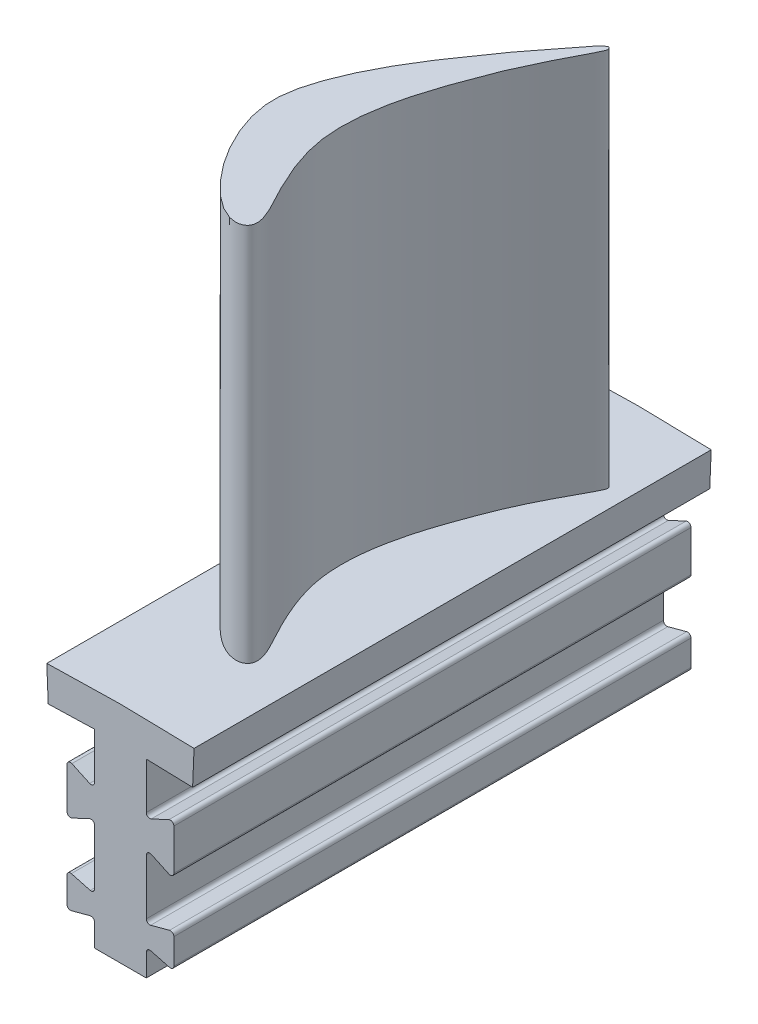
SolidWorks part; units mm, degrees
ref_plane "Front Plane" through (0, 0, 0) normal (0, 0, 1) x (1, 0, 0)
ref_plane "Top Plane" through (0, 0, 0) normal (0, 1, 0) x (1, 0, 0)
ref_plane "Right Plane" through (0, 0, 0) normal (1, 0, 0) x (0, 0, -1)
sketch "Sketch1" plane through (0, 0, 0) normal (0, 0, 1) x (1, 0, 0)
  line L0 (0, 500) -> (0, 510) construction
  line L1 (-20.9378, 499.5614) -> (-21.3566, 509.5526)
  line L2 (20.9378, 499.5614) -> (21.3566, 509.5526)
  arc A0 (20.9378, 499.5614) -> (-20.9378, 499.5614) centre (0, 0) ccw
  arc A1 (21.3566, 509.5526) -> (-21.3566, 509.5526) centre (0, 0) ccw
  dimension "D1" = 4.8
extrude "Boss-Extrude1" add sketch "Sketch1" along normal mid plane 150
ref_plane "Plane1" through (0, 750, 0) normal (0, 1, 0) x (1, 0, 0)
sketch "Sketch5" plane through (0, 0, 75) normal (0, 0, 1) x (1, 0, 0)
  line L0 (0, 500) -> (0, 402.3966) construction
  line L1 (-7.5, 499.9437) -> (-7.5, 486.5134)
  line L2 (-8.9226, 485.6071) -> (-14.0774, 488.0108)
  line L3 (-15.5, 487.1045) -> (-15.5, 475.2439)
  line L4 (-14.0774, 474.3376) -> (-8.9226, 476.7413)
  line L5 (-7.5, 475.835) -> (-7.5, 459.7971)
  line L6 (-8.7588, 458.8312) -> (-14.2412, 460.3002)
  line L7 (-15.5, 459.3343) -> (-15.5, 451.9407)
  line L8 (-14.2412, 450.9748) -> (-8.7588, 452.4438)
  line L9 (-7.5, 451.4779) -> (-7.5, 444.9437)
  line L10 (7.5, 499.9437) -> (7.5, 486.5134)
  line L11 (-7.5, 400) -> (3.7216, 400)
  line L12 (-7.5, 444.9437) -> (7.5, 444.9437)
  line L13 (8.9226, 485.6071) -> (14.0774, 488.0108)
  line L14 (15.5, 487.1045) -> (15.5, 475.2439)
  line L15 (14.0774, 474.3376) -> (8.9226, 476.7413)
  line L16 (7.5, 475.835) -> (7.5, 459.7971)
  line L17 (8.7588, 458.8312) -> (14.2412, 460.3002)
  line L18 (15.5, 459.3343) -> (15.5, 451.9407)
  line L19 (14.2412, 450.9748) -> (8.7588, 452.4438)
  line L20 (7.5, 451.4779) -> (7.5, 444.9437)
  arc A0 (20.9378, 499.5614) -> (-20.9378, 499.5614) centre (0, 0) ccw construction
  arc A1 (-14.2412, 460.3002) -> (-15.5, 459.3343) centre (-14.5, 459.3343) ccw
  arc A2 (-15.5, 451.9407) -> (-14.2412, 450.9748) centre (-14.5, 451.9407) ccw
  arc A3 (-8.7588, 452.4438) -> (-7.5, 451.4779) centre (-8.5, 451.4779) cw
  arc A4 (-7.5, 459.7971) -> (-8.7588, 458.8312) centre (-8.5, 459.7971) cw
  arc A5 (-8.9226, 476.7413) -> (-7.5, 475.835) centre (-8.5, 475.835) cw
  arc A6 (-7.5, 486.5134) -> (-8.9226, 485.6071) centre (-8.5, 486.5134) cw
  arc A7 (-14.0774, 488.0108) -> (-15.5, 487.1045) centre (-14.5, 487.1045) ccw
  arc A8 (-15.5, 475.2439) -> (-14.0774, 474.3376) centre (-14.5, 475.2439) ccw
  arc A9 (7.5, 486.5134) -> (8.9226, 485.6071) centre (8.5, 486.5134) ccw
  arc A10 (14.0774, 488.0108) -> (15.5, 487.1045) centre (14.5, 487.1045) cw
  arc A11 (15.5, 475.2439) -> (14.0774, 474.3376) centre (14.5, 475.2439) cw
  arc A12 (8.9226, 476.7413) -> (7.5, 475.835) centre (8.5, 475.835) ccw
  arc A13 (7.5, 459.7971) -> (8.7588, 458.8312) centre (8.5, 459.7971) ccw
  arc A14 (14.2412, 460.3002) -> (15.5, 459.3343) centre (14.5, 459.3343) cw
  arc A15 (15.5, 451.9407) -> (14.2412, 450.9748) centre (14.5, 451.9407) cw
  arc A16 (8.7588, 452.4438) -> (7.5, 451.4779) centre (8.5, 451.4779) ccw
  arc A17 (7.5, 499.9437) -> (-7.5, 499.9437) centre (0, 0) ccw
  point P21 (-15.5, 460.6375)
  point P25 (-15.5, 450.6375)
  point P34 (-7.5, 484.9437)
  point P37 (-15.5, 488.6742)
  point P40 (-15.5, 473.6742)
  point P67 (0, 444.9437)
  dimension "D9" = 55
  dimension "D14" = 1
  dimension "D1" = 65
  dimension "D2" = 65
  dimension "D3" = 75
  dimension "D4" = 7.5
  dimension "D5" = 7.5
  dimension "D6" = 7.5
  dimension "D7" = 15
  dimension "D8" = 10
  dimension "D10" = 75
  dimension "D11" = 15
  dimension "D12" = 8
  dimension "D13" = 8
extrude "Boss-Extrude5" add sketch "Sketch5" against normal up to surface (150 mm away) contours L4 A5 L5 A4 L6 A1 L7 A2 L8 A3 L9 L12 L20 A16 L19 A15 L18 A14 L17 A13 L16 A12 L15 A11 L14 A10 L13 A9 L10 A17 L1 A6 L2 A7 L3 A8
sketch "Sketch6" plane through (0, 750, 0) normal (0, 1, 0) x (1, 0, 0)
  line L0 (-17.003, -84.8922) -> (195.0131, 0.7679) construction
  line L2 (15.6514, 50.8983) -> (14.5317, 50.4184) construction
  line L3 (14.5317, 50.4184) -> (13.8919, 49.6719) construction
  line L4 (13.8919, 49.6719) -> (13.1987, 48.8188) construction
  line L5 (13.1987, 48.8188) -> (12.7722, 48.179) construction
  line L6 (12.7722, 48.179) -> (11.9191, 46.9527) construction
  line L7 (11.9191, 46.9527) -> (11.4925, 46.5794) construction
  line L8 (11.4925, 46.5794) -> (11.0127, 45.833) construction
  line L9 (11.0127, 45.833) -> (10.5328, 45.3531) construction
  line L10 (10.5328, 45.3531) -> (9.9463, 44.3934) construction
  line L11 (9.9463, 44.3934) -> (9.4131, 43.5936) construction
  line L12 (9.4131, 43.5936) -> (8.4534, 42.154) construction
  line L13 (8.4534, 42.154) -> (6.6878, 40.5093) construction
  line L14 (6.6878, 40.5093) -> (5.7769, 39.4971) construction
  line L15 (5.7769, 39.4971) -> (4.8406, 38.3585) construction
  line L16 (4.8406, 38.3585) -> (4.1827, 37.4222) construction
  line L17 (4.1827, 37.4222) -> (3.5248, 36.4859) construction
  line L18 (3.5248, 36.4859) -> (2.538, 35.0183) construction
  line L19 (2.538, 35.0183) -> (1.5005, 33.8037) construction
  line L20 (1.5005, 33.8037) -> (0.6148, 32.4373) construction
  line L21 (0.6148, 32.4373) -> (-0.0431, 31.2733) construction
  line L22 (-0.0431, 31.2733) -> (-0.5745, 30.2864) construction
  line L23 (-0.5745, 30.2864) -> (-1.2071, 29.1224) construction
  line L24 (-1.2071, 29.1224) -> (-2.0421, 28.2874) construction
  line L25 (-2.0421, 28.2874) -> (-2.447, 27.6548) construction
  line L26 (-2.447, 27.6548) -> (-3.0037, 26.9463) construction
  line L27 (-3.0037, 26.9463) -> (-4.0715, 25.5481) construction
  line L28 (-4.0715, 25.5481) -> (-4.604, 24.6093) construction
  line L29 (-4.604, 24.6093) -> (-5.3466, 23.6705) construction
  line L30 (-5.3466, 23.6705) -> (-5.739, 23.054) construction
  line L31 (-5.739, 23.054) -> (-6.1734, 22.4935) construction
  line L32 (-6.1734, 22.4935) -> (-6.5377, 21.947) construction
  line L33 (-6.5377, 21.947) -> (-7.238, 20.821) construction
  line L34 (-7.238, 20.821) -> (-7.7324, 20.0794) construction
  line L35 (-7.7324, 20.0794) -> (-8.3779, 19.1043) construction
  line L36 (-8.3779, 19.1043) -> (-8.7075, 18.4313) construction
  line L37 (-8.7075, 18.4313) -> (-9.0783, 17.8682) construction
  line L38 (-9.0783, 17.8682) -> (-9.9998, 16.4444) construction
  line L39 (-9.9998, 16.4444) -> (-10.6616, 15.2572) construction
  line L40 (-10.6616, 15.2572) -> (-11.1871, 14.2256) construction
  line L41 (-11.1871, 14.2256) -> (-11.5958, 13.525) construction
  line L42 (-11.5958, 13.525) -> (-12.2335, 12.5823) construction
  line L43 (-12.2335, 12.5823) -> (-13.2661, 11.0731) construction
  line L44 (-13.2661, 11.0731) -> (-13.9413, 9.4448) construction
  line L45 (-13.9413, 9.4448) -> (-15.0533, 7.737) construction
  line L46 (-15.0533, 7.737) -> (-15.5696, 6.2278) construction
  line L47 (-15.5696, 6.2278) -> (-16.1256, 5.1952) construction
  line L48 (-16.1256, 5.1952) -> (-16.5228, 4.1626) construction
  line L49 (-16.5228, 4.1626) -> (-17.1582, 3.0506) construction
  line L50 (-17.1582, 3.0506) -> (-17.5554, 1.9782) construction
  line L51 (-17.5554, 1.9782) -> (-18.1908, 0.2705) construction
  line L52 (-18.1908, 0.2705) -> (-18.4688, -1.3976) construction
  line L53 (-18.4688, -1.3976) -> (-19.0584, -3.0417) construction
  line L55 (-19.0584, -3.0417) -> (-19.5501, -4.6954) construction
  line L56 (-19.5501, -4.6954) -> (-19.8406, -5.7234) construction
  line L57 (-19.8406, -5.7234) -> (-19.997, -6.7514) construction
  line L58 (-19.997, -6.7514) -> (-20.2205, -7.757) construction
  line L59 (-20.2205, -7.757) -> (-20.2205, -8.4274) construction
  line L60 (-20.2205, -8.4274) -> (-20.2205, -9.0308) construction
  line L61 (-20.2205, -9.0308) -> (-20.4216, -9.7906) construction
  line L62 (-20.4216, -9.7906) -> (-20.4216, -10.5728) construction
  line L63 (-20.4216, -10.5728) -> (-20.4216, -11.2432) construction
  line L64 (-20.4216, -11.2432) -> (-20.4216, -12.2489) construction
  line L65 (-20.4216, -12.2489) -> (-20.4216, -12.9193) construction
  line L66 (-20.4216, -12.9193) -> (-20.4216, -13.81) construction
  line L67 (-20.4216, -13.81) -> (-20.4216, -15.0819) construction
  line L68 (-20.4216, -15.0819) -> (-20.0402, -16.1629) construction
  line L69 (-20.0402, -16.1629) -> (-20.0402, -17.2122) construction
  line L70 (-20.0402, -17.2122) -> (-19.4996, -18.4205) construction
  line L71 (-19.4996, -18.4205) -> (-19.2135, -19.6287) construction
  line L72 (-19.2135, -19.6287) -> (-18.8944, -21.167) construction
  line L73 (-18.8944, -21.167) -> (-18.0957, -22.6871) construction
  line L74 (-18.0957, -22.6871) -> (-17.5546, -24.3875) construction
  line L75 (-17.5546, -24.3875) -> (-16.9106, -26.7062) construction
  line L76 (-16.9106, -26.7062) -> (-16.1376, -28.6385) construction
  line L77 (-16.1376, -28.6385) -> (-15.4163, -29.7721) construction
  line L78 (-15.4163, -29.7721) -> (-14.7722, -31.3179) construction
  line L79 (-14.7722, -31.3179) -> (-14.1538, -32.6834) construction
  line L80 (-14.1538, -32.6834) -> (-13.5613, -33.5593) construction
  line L81 (-13.5613, -33.5593) -> (-11.3632, -35.5828) construction
  line L82 (-11.3632, -35.5828) -> (-9.6984, -37.2914) construction
  line L83 (-9.6984, -37.2914) -> (-8.2964, -39.0001) construction
  line L84 (-8.2964, -39.0001) -> (-7.0259, -40.402) construction
  line L85 (-7.0259, -40.402) -> (-5.6239, -41.7164) construction
  line L86 (-5.6239, -41.7164) -> (-4.4574, -42.6089) construction
  line L87 (-4.4574, -42.6089) -> (-4.0605, -42.9713) construction
  line L88 (-4.0605, -42.9713) -> (-3.6636, -43.3855) construction
  line L89 (-3.6636, -43.3855) -> (-3.1804, -43.7307) construction
  line L90 (-3.1804, -43.7307) -> (-2.5418, -44.1103) construction
  line L91 (-2.5418, -44.1103) -> (-2.0932, -44.559) construction
  line L92 (-2.0932, -44.559) -> (-1.5237, -44.8697) construction
  line L93 (-1.5237, -44.8697) -> (-0.8334, -45.5427) construction
  line L94 (-0.8334, -45.5427) -> (-0.1258, -45.9569) construction
  line L95 (-0.1258, -45.9569) -> (0.4264, -46.2503) construction
  line L96 (0.4264, -46.2503) -> (1.3437, -46.769) construction
  line L97 (1.3437, -46.769) -> (2.1687, -47.2699) construction
  line L98 (2.1687, -47.2699) -> (2.6107, -47.5056) construction
  line L99 (2.6107, -47.5056) -> (3.3768, -48.036) construction
  line L100 (3.3768, -48.036) -> (3.9071, -48.2717) construction
  line L101 (3.9071, -48.2717) -> (4.5848, -48.2717) construction
  line L102 (4.5848, -48.2717) -> (5.1446, -48.7136) construction
  line L103 (5.1446, -48.7136) -> (5.4982, -48.7726) construction
  line L104 (5.4982, -48.7726) -> (6.1464, -48.7726) construction
  line L105 (6.1464, -48.7726) -> (6.4706, -48.9494) construction
  line L106 (6.4706, -48.9494) -> (7.3545, -48.5958) construction
  line L107 (7.3545, -48.5958) -> (8.0322, -48.2717) construction
  line L108 (8.0322, -48.2717) -> (8.4447, -48.2717) construction
  line L109 (8.4447, -48.2717) -> (9.5054, -47.7119) construction
  line L110 (9.5054, -47.7119) -> (9.8884, -47.3583) construction
  line L111 (9.8884, -47.3583) -> (10.0947, -46.8279) construction
  line L112 (10.0947, -46.8279) -> (10.242, -46.5922) construction
  line L113 (10.242, -46.5922) -> (10.242, -46.2976) construction
  line L114 (10.242, -46.2976) -> (10.242, -45.8556) construction
  line L115 (10.242, -45.8556) -> (10.242, -45.2958) construction
  line L116 (10.242, -45.2958) -> (10.242, -44.9127) construction
  line L117 (10.242, -44.9127) -> (9.9474, -44.6475) construction
  line L118 (9.9474, -44.6475) -> (9.9474, -44.1761) construction
  line L119 (9.9474, -44.1761) -> (9.5349, -43.6163) construction
  line L120 (9.5349, -43.6163) -> (9.5349, -43.1448) construction
  line L121 (9.5349, -43.1448) -> (9.2697, -42.7913) construction
  line L122 (9.2697, -42.7913) -> (9.2697, -42.3788) construction
  line L123 (9.2697, -42.3788) -> (8.9161, -41.8484) construction
  line L124 (8.9161, -41.8484) -> (8.5036, -41.0823) construction
  line L125 (8.5036, -41.0823) -> (8.2384, -40.4046) construction
  line L126 (8.2384, -40.4046) -> (8.0027, -39.5502) construction
  line L127 (8.0027, -39.5502) -> (7.6491, -38.9903) construction
  line L128 (7.6491, -38.9903) -> (7.2661, -38.5189) construction
  line L129 (7.2661, -38.5189) -> (7.0012, -38.1819) construction
  line L130 (7.0012, -38.1819) -> (6.8413, -37.87) construction
  line L131 (6.8413, -37.87) -> (6.7373, -37.6222) construction
  line L132 (6.7373, -37.6222) -> (6.6094, -37.4463) construction
  line L133 (6.6094, -37.4463) -> (6.4655, -37.2944) construction
  line L134 (6.4655, -37.2944) -> (6.3455, -37.1584) construction
  line L135 (6.3455, -37.1584) -> (6.2096, -37.0145) construction
  line L136 (6.2096, -37.0145) -> (5.6242, -36.1547) construction
  line L137 (5.6242, -36.1547) -> (4.9926, -35.0888) construction
  line L138 (4.9926, -35.0888) -> (4.4794, -34.1019) construction
  line L139 (4.4794, -34.1019) -> (4.1636, -33.4703) construction
  line L140 (4.1636, -33.4703) -> (3.2951, -31.9307) construction
  line L141 (3.2951, -31.9307) -> (2.9793, -31.2597) construction
  line L142 (2.9793, -31.2597) -> (2.7424, -30.5096) construction
  line L143 (2.7424, -30.5096) -> (2.3082, -29.7991) construction
  line L144 (2.3082, -29.7991) -> (1.6766, -28.7727) construction
  line L145 (1.6766, -28.7727) -> (1.6766, -28.0621) construction
  line L146 (1.6766, -28.0621) -> (1.2424, -27.5489) construction
  line L147 (1.2424, -27.5489) -> (1.045, -27.1937) construction
  line L148 (1.045, -27.1937) -> (0.4528, -26.1278) construction
  line L149 (0.4528, -26.1278) -> (0.4528, -25.4567) construction
  line L150 (0.4528, -25.4567) -> (-0.2182, -24.3514) construction
  line L151 (-0.2182, -24.3514) -> (-0.4946, -23.6014) construction
  line L152 (-0.4946, -23.6014) -> (-0.4946, -22.5132) construction
  line L153 (-0.4946, -22.5132) -> (-1.1999, -21.441) construction
  line L154 (-1.1999, -21.441) -> (-1.5729, -20.2755) construction
  line L155 (-1.5729, -20.2755) -> (-1.8992, -19.4364) construction
  line L156 (-1.8992, -19.4364) -> (-2.2255, -18.504) construction
  line L157 (-2.2255, -18.504) -> (-2.5985, -17.6183) construction
  line L158 (-2.5985, -17.6183) -> (-2.5985, -16.5927) construction
  line L159 (-2.5985, -16.5927) -> (-2.9248, -16.1266) construction
  line L160 (-2.9248, -16.1266) -> (-2.9248, -15.3341) construction
  line L161 (-2.9248, -15.3341) -> (-3.018, -15.101) construction
  line L162 (-3.018, -15.101) -> (-3.018, -14.1686) construction
  line L163 (-3.018, -14.1686) -> (-2.9248, -13.6558) construction
  line L164 (-2.9248, -13.6558) -> (-2.9248, -13.0498) construction
  line L165 (-2.9248, -13.0498) -> (-2.9248, -12.2573) construction
  line L166 (-2.9248, -12.2573) -> (-2.9248, -11.4648) construction
  line L167 (-2.9248, -11.4648) -> (-2.9248, -10.8588) construction
  line L168 (-2.9248, -10.8588) -> (-3.3276, -9.8661) construction
  line L169 (-3.3276, -9.8661) -> (-3.3276, -9.1291) construction
  line L170 (-3.3276, -9.1291) -> (-3.3276, -7.8855) construction
  line L171 (-3.3276, -7.8855) -> (-3.3276, -7.2867) construction
  line L172 (-3.3276, -7.2867) -> (-3.3276, -6.4115) construction
  line L173 (-3.3276, -6.4115) -> (-3.1894, -5.9049) construction
  line L174 (-3.1894, -5.9049) -> (-3.1894, -4.8915) construction
  line L175 (-3.1894, -4.8915) -> (-3.1894, -4.2467) construction
  line L176 (-3.1894, -4.2467) -> (-3.0513, -3.694) construction
  line L177 (-3.0513, -3.694) -> (-3.0513, -3.0491) construction
  line L178 (-3.0513, -3.0491) -> (-3.0513, -2.1279) construction
  line L179 (-3.0513, -2.1279) -> (-3.0513, -1.4831) construction
  line L180 (-3.0513, -1.4831) -> (-3.0513, -0.6289) construction
  line L181 (-3.0513, -0.6289) -> (-2.7089, 0.2402) construction
  line L182 (-2.7089, 0.2402) -> (-2.7089, 3.0004) construction
  line L183 (-2.7089, 3.0004) -> (-2.0055, 4.5017) construction
  line L184 (-2.0055, 4.5017) -> (-2.0055, 6.9167) construction
  line L185 (-2.0055, 6.9167) -> (-1.3528, 7.8958) construction
  line L186 (-1.3528, 7.8958) -> (-1.3528, 8.9402) construction
  line L187 (-1.3528, 8.9402) -> (-0.8306, 10.1151) construction
  line L188 (-0.8306, 10.1151) -> (-0.1779, 11.4858) construction
  line L189 (-0.1779, 11.4858) -> (0.3443, 13.1829) construction
  line L190 (0.3443, 13.1829) -> (0.736, 14.3578) construction
  line L191 (0.736, 14.3578) -> (0.736, 15.3368) construction
  line L192 (0.736, 15.3368) -> (1.5192, 15.9896) construction
  line L193 (1.5192, 15.9896) -> (1.9109, 17.295) construction
  line L194 (1.9109, 17.295) -> (2.1778, 18.819) construction
  line L195 (2.1778, 18.819) -> (2.7376, 19.6027) construction
  line L196 (2.7376, 19.6027) -> (3.673, 21.8909) construction
  line L197 (3.673, 21.8909) -> (3.673, 22.8957) construction
  line L198 (3.673, 22.8957) -> (4.4134, 24.4295) construction
  line L199 (4.4134, 24.4295) -> (4.8365, 25.4873) construction
  line L200 (4.8365, 25.4873) -> (4.8365, 26.1219) construction
  line L201 (4.8365, 26.1219) -> (5.4712, 27.021) construction
  line L202 (5.4712, 27.021) -> (5.4712, 28.0259) construction
  line L203 (5.4712, 28.0259) -> (6.2645, 29.0837) construction
  line L204 (6.2645, 29.0837) -> (6.5289, 29.6126) construction
  line L205 (6.5289, 29.6126) -> (6.5289, 30.3001) construction
  line L206 (6.5289, 30.3001) -> (6.9521, 30.8819) construction
  line L207 (6.9521, 30.8819) -> (7.3223, 31.781) construction
  line L208 (7.3223, 31.781) -> (7.5867, 32.3099) construction
  line L209 (7.5867, 32.3099) -> (8.1685, 33.1032) construction
  line L210 (8.1685, 33.1032) -> (8.6445, 34.0023) construction
  line L211 (8.6445, 34.0023) -> (9.0724, 35.7733) construction
  line L212 (9.0724, 35.7733) -> (9.0724, 36.7177) construction
  line L213 (9.0724, 36.7177) -> (9.9538, 37.725) construction
  line L214 (9.9538, 37.725) -> (10.9612, 39.362) construction
  line L215 (10.9612, 39.362) -> (11.5908, 40.6841) construction
  line L216 (11.5908, 40.6841) -> (12.4722, 42.0692) construction
  line L217 (12.4722, 42.0692) -> (13.3536, 43.7691) construction
  line L218 (13.3536, 43.7691) -> (14.298, 45.1542) construction
  line L219 (14.298, 45.1542) -> (14.9276, 46.5394) construction
  line L220 (14.9276, 46.5394) -> (14.9276, 47.2628) construction
  line L221 (14.9276, 47.2628) -> (15.1768, 47.7408) construction
  line L222 (15.1768, 47.7408) -> (15.5055, 48.2488) construction
  line L223 (15.5055, 48.2488) -> (15.9238, 48.8464) construction
  line L224 (15.9238, 48.8464) -> (16.4019, 49.3543) construction
  line L225 (16.4019, 49.3543) -> (16.4616, 49.683) construction
  line L226 (16.4616, 49.683) -> (16.3128, 50.0763) construction
  line L227 (16.3128, 50.0763) -> (16.3128, 50.1979) construction
  line L228 (16.3128, 50.1979) -> (16.2561, 50.2628) construction
  line L229 (16.2561, 50.2628) -> (16.2561, 50.3682) construction
  line L230 (16.2561, 50.3682) -> (16.1912, 50.433) construction
  line L231 (16.1912, 50.433) -> (16.1669, 50.4898) construction
  line L232 (16.1669, 50.4898) -> (16.1101, 50.5709) construction
  line L233 (16.1101, 50.5709) -> (16.0703, 50.6278) construction
  line L234 (16.0372, 50.6763) -> (15.9642, 50.7655) construction
  line L235 (15.9642, 50.7655) -> (15.8886, 50.8145) construction
  line L236 (15.9642, 50.7655) -> (15.8886, 50.8145) construction
  line L237 (15.8886, 50.8145) -> (15.8345, 50.8547) construction
  line L238 (15.8345, 50.8547) -> (15.7534, 50.8952) construction
  line L239 (15.7534, 50.8952) -> (15.6514, 50.8983) construction
  line L240 (16.0703, 50.6278) -> (16.0007, 50.7209) construction
  line L241 (16.0007, 50.7209) -> (15.9264, 50.79) construction
  line L242 (15.9264, 50.79) -> (15.8886, 50.8145) construction
  line L243 (15.8886, 50.8145) -> (15.7984, 50.8629) construction
  line L244 (15.7984, 50.8629) -> (15.7534, 50.8952) construction
  line L245 (15.7534, 50.8952) -> (15.6514, 50.8983) construction
  spline_without_curve S0
  spline_without_curve S1
  spline_without_curve S2
extrude "Boss-Extrude6" add sketch "Sketch6" against normal up to surface (240.2545 mm away) contours S0 S2
sketch "Sketch7" plane through (0, 750, 0) normal (0, 1, 0) x (1, 0, 0)
  line L0 (-20.9378, 75) -> (20.9378, 75)
  line L1 (-20.9378, 75) -> (-20.9378, -74.0477)
  line L2 (20.9378, 75) -> (20.9378, -74.0477)
  line L3 (-20.9378, -74.0477) -> (20.9378, -74.0477)
extrude "Cut-Extrude1" cut sketch "Sketch7" against normal blind 130
